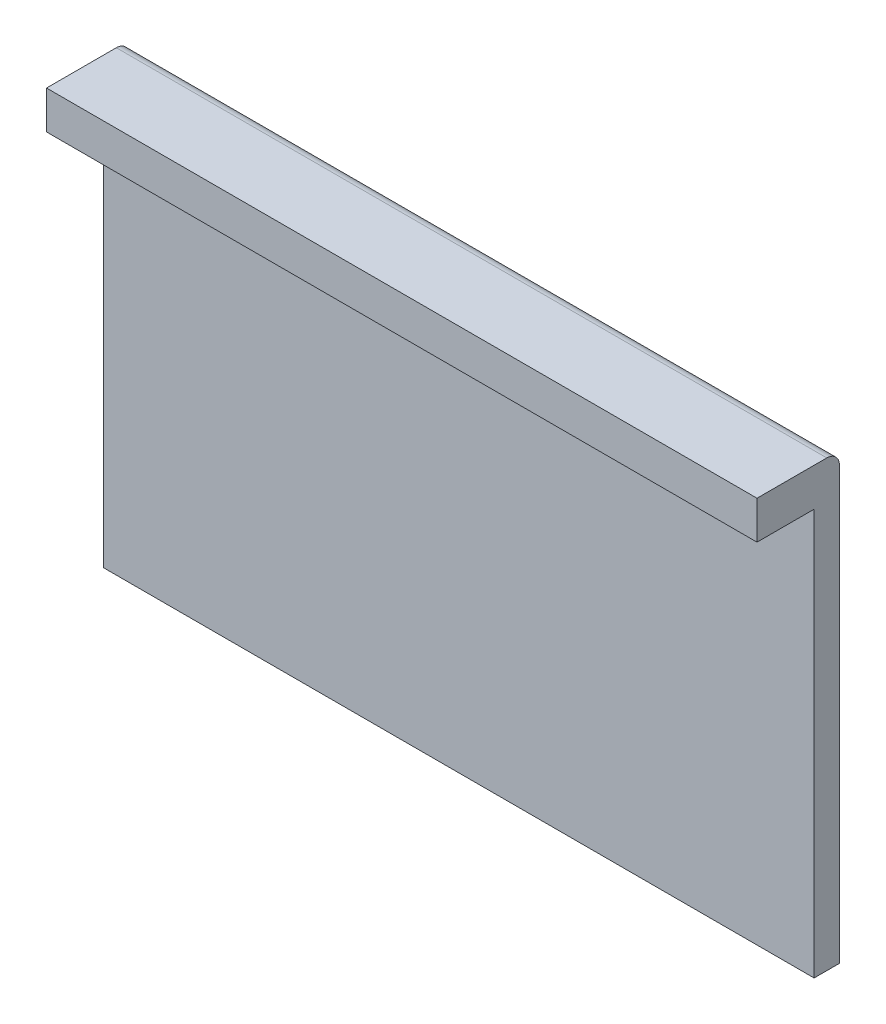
SolidWorks part; units mm, degrees
ref_plane "Plan1" through (0, 0, 0) normal (0, 0, 1) x (1, 0, 0)
ref_plane "Plan2" through (0, 0, 0) normal (0, 1, 0) x (1, 0, 0)
ref_plane "Plan3" through (0, 0, 0) normal (1, 0, 0) x (0, 0, -1)
sketch "Esquisse1" plane through (0, 0, 0) normal (0, 0, 1) x (1, 0, 0)
  line L1 (4, 0) -> (60, 0)
  line L2 (4, 0) -> (4, 35)
  line L3 (4, 35) -> (60, 35)
  line L4 (60, 0) -> (60, 35)
  dimension "D1" = 35
  dimension "D2" = 56
extrude "Base-Extrusion" add sketch "Esquisse1" along normal blind 2
sketch "Esquisse2" plane through (0, 0, 2) normal (0, 0, 1) x (1, 0, 0)
  line L1 (4, 35) -> (60, 35)
  line L2 (4, 35) -> (4, 32)
  line L3 (4, 32) -> (60, 32)
  line L4 (60, 35) -> (60, 32)
  dimension "D1" = 3
extrude "Boss.-Extru.1" add sketch "Esquisse2" along normal blind 4.5
fillet "Congé1" radius 1
